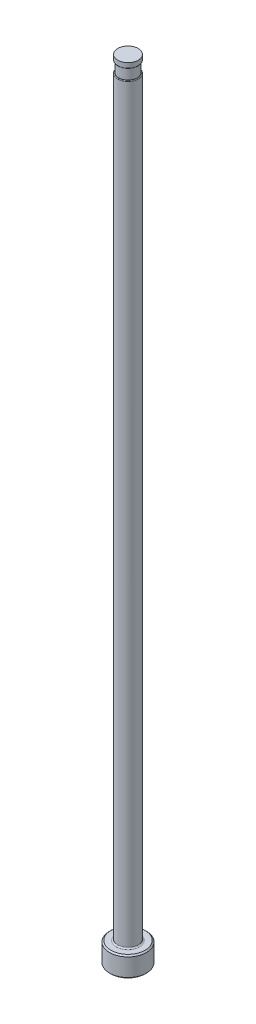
SolidWorks part; units mm, degrees
ref_plane "Front Plane" through (0, 0, 0) normal (0, 0, 1) x (1, 0, 0)
ref_plane "Top Plane" through (0, 0, 0) normal (0, 1, 0) x (1, 0, 0)
ref_plane "Right Plane" through (0, 0, 0) normal (1, 0, 0) x (0, 0, -1)
other "Configuration Table"
sketch "Sketch1" plane through (0, 0, 0) normal (0, 0, 1) x (1, 0, 0)
  line L0 (0, 259.9588) -> (0, -15.1925) construction
  line L1 (0, 0) -> (-3.5687, 0)
  line L2 (-3.5687, 0) -> (-3.5687, 3.9624)
  line L3 (-3.5687, 3.9624) -> (-1.9837, 3.9624)
  line L4 (-1.9837, 3.9624) -> (-1.9837, 152.4)
  line L5 (-1.9837, 152.4) -> (0, 152.4)
  line L6 (0, 152.4) -> (0, 0)
  dimension "L" = 152.4
  dimension "H" = 7.1374
  dimension "T" = 3.9624
  dimension "D" = 3.9675
revolve "Revolve1" add sketch "Sketch1" angle 360 about L0
chamfer "Chamfer1" distance 0.254 angle 45 2 edges at (0, 3.9624, 3.5687) (0, 0, 3.5687)
fillet "Fillet1" radius 0.254 1 edges at (0, 3.9624, 1.9837)
sketch "Sketch2" plane through (0, 0, 0) normal (0, 0, 1) x (1, 0, 0)
  line L0 (-1.9837, 152.4) -> (-1.9837, 4.2164) construction
  line L1 (-1.9837, 151.384) -> (-1.7805, 151.384)
  line L2 (-1.9837, 151.384) -> (-1.9837, 149.352)
  line L3 (-1.9837, 149.352) -> (-1.7805, 149.352)
  line L4 (-1.7805, 151.384) -> (-1.7805, 149.352)
  line L5 (1.9837, 152.4) -> (-1.9837, 152.4) construction
  line L6 (0, 153.4483) -> (0, 147.3282) construction
  dimension "D1" = 2.032
  dimension "N" = 1.016
  dimension "FD" = 0.2032
  dimension "D3" = 3.5611
revolve "Vent Relief" cut sketch "Sketch2" angle 360 about L6
sketch "Sketch3" plane through (0, 0, 0) normal (0, 0, 1) x (1, 0, 0)
  line L0 (-1.7805, 150.368) -> (-1.7805, 86.868)
  line L1 (-1.7805, 151.384) -> (-1.7805, 149.352) construction
  line L2 (-1.9837, 149.352) -> (-1.9837, 4.2164) construction
  line L3 (-1.9837, 85.7504) -> (-1.9837, 150.368)
  line L4 (-1.9837, 150.368) -> (-1.7805, 150.368)
  arc A0 (-1.7805, 86.868) -> (-1.9837, 85.7504) centre (-4.9555, 86.868) cw
  dimension "D1" = 3.175
  dimension "D2" = 63.5
extrude "D-Slot" cut sketch "Sketch3" against normal through all both and the other way through all
sketch "Sketch5" plane through (0, 0, 0) normal (0, 0, 1) x (1, 0, 0)
  line L0 (-1.9837, 151.384) -> (1.9837, 151.384) construction
  line L1 (-1.9837, 152.4) -> (-1.9787, 152.4)
  line L2 (-1.9837, 152.4) -> (-1.9837, 151.384)
  line L3 (-1.9837, 151.384) -> (-1.9787, 151.384)
  line L4 (-1.9787, 152.4) -> (-1.9787, 151.384)
  line L5 (0, 152.6877) -> (0, 150.5771) construction
  dimension "VP" = 0.0051
revolve "Vent Diameter" cut sketch "Sketch5" angle 360 about L5
fillet "Fillet2" radius 0.127 2 edges at (1.9837, 149.352, 0) (0, 151.384, 1.9787)
sketch "Pocket Sketch" plane through (0, 0, 0) normal (0, 0, 1) x (1, 0, 0)
  line L0 (-3.9656, 0) -> (-3.9656, 3.9878)
  line L1 (-3.9656, 3.9878) -> (-2.9442, 3.9878)
  line L2 (-2.1822, 4.7498) -> (-2.1822, 22.225)
  line L3 (-2.1822, 22.225) -> (0, 22.225)
  line L4 (0, 22.225) -> (0, 0)
  line L5 (0, 0) -> (-3.9656, 0)
  line L6 (0, 12.6104) -> (0, -2.4989) construction
  line L7 (-3.5687, 3.7084) -> (-3.5687, 0.254) construction
  line L8 (3.3147, 3.9624) -> (-3.3147, 3.9624) construction
  line L9 (-1.9837, 85.7504) -> (-1.9837, 4.2164) construction
  line L10 (-2.9442, 3.9878) -> (-2.1822, 4.7498)
  point P3 (-2.1822, 3.9878)
  dimension "D1" = 7.9311
  dimension "D2" = 0.3969
  dimension "D3" = 0.0254
  dimension "D4" = 0.1984
  dimension "D5" = 4.3644
  dimension "D6" = 22.225
